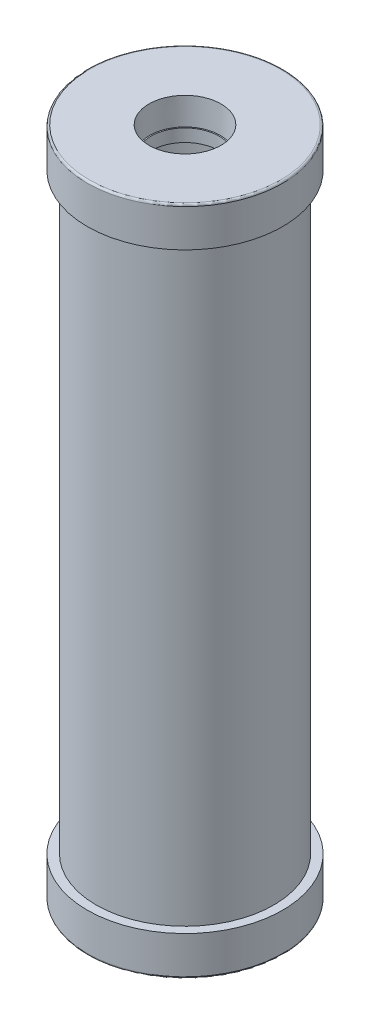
SolidWorks part; units mm, degrees
ref_plane "Front Plane" through (0, 0, 0) normal (0, 0, 1) x (1, 0, 0)
ref_plane "Top Plane" through (0, 0, 0) normal (0, 1, 0) x (1, 0, 0)
ref_plane "Right Plane" through (0, 0, 0) normal (1, 0, 0) x (0, 0, -1)
sketch "Sketch1" plane through (0, 0, 0) normal (0, 1, 0) x (1, 0, 0)
  circle A0 centre (0, 0) radius 57.15
  circle A1 centre (0, 0) radius 50.546
  dimension "D1" = 114.3
  dimension "D2" = 6.604
extrude "Boss-Extrude1" add sketch "Sketch1" along normal blind 431.8
sketch "Sketch2" plane through (0, 0, 0) normal (0, 1, 0) x (1, 0, 0)
  circle A0 centre (0, 0) radius 62.865
  dimension "D1" = 125.73
extrude "Boss-Extrude2" add sketch "Sketch2" along normal blind 25.4
hole_wizard "1-1/2 NPT Tapped Hole1" positions "Sketch4" profile "Sketch3" size "1-1/2" standard "ANSI Inch"
sketch "Sketch4" plane through (0, 0, 0) normal (0, 1, 0) x (1, 0, 0)
  point P0 (0, 0)
sketch "Sketch3" plane through (0, 0, 0) normal (1, 0, 0) x (0, 0, -1)
  line L0 (0, 0) -> (0, 41.5656)
  line L1 (21.8313, 28.448) -> (0, 41.5656)
  line L2 (-21.8313, 28.448) -> (0, 41.5656) construction
  line L3 (21.8313, 28.448) -> (21.8313, 17.272)
  line L4 (21.8313, 17.272) -> (22.6259, 17.272)
  line L5 (22.6259, 17.272) -> (23.143, 0)
  line L6 (-22.6259, 17.272) -> (-23.143, 0) construction
  line L7 (23.143, 0) -> (0, 0)
  line L8 (0, -6.35) -> (0, 107.95) construction
  line L11 (-21.8313, 17.272) -> (-22.6259, 17.272) construction
  dimension "Tap Drill Dia." = 43.6626
  dimension "Tap Drill Depth" = 28.448
  dimension "Thread Dia." = 46.2861
  dimension "Thread Angle" = 3.43
  dimension "Thread Depth" = 17.272
  dimension "Drill Angle" = 118
ref_plane "Plane1" through (0, 431.8, 0) normal (0, 1, 0) x (1, 0, 0)
sketch "Sketch5" plane through (0, 431.8, 0) normal (0, 1, 0) x (1, 0, 0)
  circle A0 centre (0, 0) radius 62.865
  dimension "D1" = 125.73
extrude "Boss-Extrude3" add sketch "Sketch5" against normal blind 25.4
hole_wizard "1-1/2 NPT Tapped Hole2" positions "Sketch7" profile "Sketch6" size "1-1/2" standard "ANSI Inch"
sketch "Sketch7" plane through (0, 431.8, 0) normal (0, 1, 0) x (1, 0, 0)
  point P0 (0, 0)
sketch "Sketch6" plane through (0, 431.8, 0) normal (1, 0, 0) x (0, 0, 1)
  line L0 (0, 0) -> (0, 41.5656)
  line L1 (21.8313, 28.448) -> (0, 41.5656)
  line L2 (-21.8313, 28.448) -> (0, 41.5656) construction
  line L3 (21.8313, 28.448) -> (21.8313, 17.272)
  line L4 (21.8313, 17.272) -> (22.6259, 17.272)
  line L5 (22.6259, 17.272) -> (23.143, 0)
  line L6 (-22.6259, 17.272) -> (-23.143, 0) construction
  line L7 (23.143, 0) -> (0, 0)
  line L8 (0, -6.35) -> (0, 107.95) construction
  line L11 (-21.8313, 17.272) -> (-22.6259, 17.272) construction
  dimension "Tap Drill Dia." = 43.6626
  dimension "Tap Drill Depth" = 28.448
  dimension "Thread Dia." = 46.2861
  dimension "Thread Angle" = 3.43
  dimension "Thread Depth" = 17.272
  dimension "Drill Angle" = 118
fillet "Fillet1" radius 1.27 2 edges at (0, 0, 62.865) (0, 431.8, 62.865)
